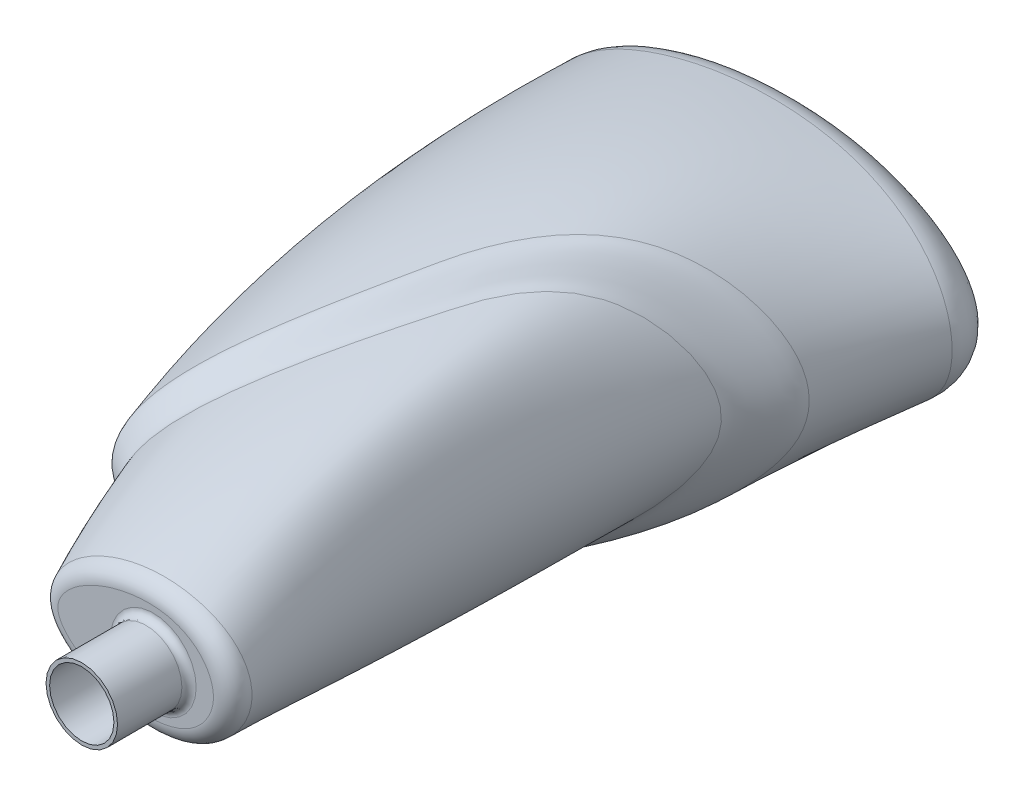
SolidWorks part; units mm, degrees
ref_plane "Płaszczyzna przednia" through (0, 0, 0) normal (0, 0, 1) x (1, 0, 0)
ref_plane "Płaszczyzna górna" through (0, 0, 0) normal (0, 1, 0) x (1, 0, 0)
ref_plane "Płaszczyzna prawa" through (0, 0, 0) normal (1, 0, 0) x (0, 0, -1)
sketch "Szkic1" plane through (0, 0, 0) normal (0, 0, 1) x (1, 0, 0)
  ellipse E0 centre (0, 0) end of major axis (-60, 0) minor radius 30
  point P1 (0, 0)
  dimension "D1" = 120
  dimension "D2" = 60
ref_plane "Płaszczyzna1" through (0, 0, 210) normal (0, 0, 1) x (1, 0, 0)
sketch "Szkic2" plane through (0, 0, 210) normal (0, 0, 1) x (1, 0, 0)
  ellipse E0 centre (20, 0) end of major axis (-10, 0) minor radius 20
  point P1 (0, 0)
  point P7 (0, 0)
  point P9 (-9.1396, 0)
  point P10 (0, 0)
  dimension "D1" = 20
  dimension "D2" = 60
  dimension "D3" = 40
sketch "Szkic3" plane through (0, 0, 0) normal (0, 1, 0) x (1, 0, 0)
  arc A0 (-10, -210) -> (-60, 0) centre (339.6883, -15.7885) cw
  dimension "D1" = 400
sketch "Szkic4" plane through (0, 0, 0) normal (0, 1, 0) x (1, 0, 0)
  arc A0 (50, -210) -> (60, 0) centre (440.5036, -123.3573) cw
  dimension "D1" = 400
ref_plane "Płaszczyzna2" through (0, 0, 0) normal (0.9955, 0, -0.0948) x (-0.0948, 0, -0.9955)
sketch "Szkic5" plane through (0, 0, 0) normal (0.9955, 0, -0.0948) x (-0.0948, 0, -0.9955)
  arc A0 (-210.9502, -20) -> (0, -30) centre (-84.7619, 411.945) ccw
  dimension "D1" = 450
sketch "Szkic6" plane through (0, 0, 0) normal (0.9955, 0, -0.0948) x (-0.0948, 0, -0.9955)
  arc A0 (-210.9502, 20) -> (0, 30) centre (-84.7619, -411.945) cw
  dimension "D1" = 450
sketch "Szkic7" plane through (0, 0, 0) normal (0, 1, 0) x (1, 0, 0)
  arc A0 (-50, -170) -> (0, -100) centre (-141.9344, -51.4754) ccw construction
  arc A1 (0, -100) -> (60, -40) centre (91.1688, -131.1688) cw construction
  spline S0 degree 3 poles (-50, -170) (-28.0442, -152.9699) (-11.5237, -130.6281) (-1.6743, -104.646) (-1.2839, -103.6162) (-0.5259, -101.5481) (0.5361, -98.4183) (1.3202, -96.3596) (1.7297, -95.3373) (12.3355, -68.8642) (33.0149, -49.2257) (60, -40) knots 0 0 0 0 0.473796 0.473796 0.473796 0.493055 0.512314 0.531572 0.531572 0.531572 1 1 1 1 weights 1 0.975065 0.975065 1 1 1 1 1 1 0.939265 0.939265 1
  point P5 (0, 0)
  dimension "D6" = 150
  dimension "D1" = 40
  dimension "D2" = 60
  dimension "D3" = 170
  dimension "D4" = 50
  dimension "D5" = 100
surface "Powierzchnia-Wyciągnięcie po profilach1"
surface "Powierzchnia-Odsunięcie1" parameters "D1"=5
surface "Powierzchnia-Wyciągnięcie1" sketch "Szkic7" parameters "D1"=100
surface "Powierzchnia-Odsunięcie2" parameters "D1"=10
surface "Powierzchnia-Przytnij1"
surface "Powierzchnia-Przytnij2"
other "Granica-Powierzchnia1"
ref_plane "Płaszczyzna3" through (0, 0, 200) normal (0, 0, 1) x (1, 0, 0)
surface "Powierzchnia-Przytnij3"
surface "Powierzchnia-Płaszczyzna1"
surface "Powierzchnia-Płaszczyzna2"
fillet "Zaokrąglenie1" radius 5 3 edges
fillet "Zaokrąglenie2" radius 10 3 edges
surface "Powierzchnia-Połącz1"
sketch "Szkic8" plane through (0, 0, 200) normal (0, 0, 1) x (1, 0, 0)
  circle A0 centre (20, 0) radius 10
  dimension "D1" = 20
extrude "Dodanie-wyciągnięcie1" add sketch "Szkic8" along normal blind 20
fillet "Zaokrąglenie3" radius 2 1 edges at (30, 0, 200)
shell "Skorupa1" thickness 1
